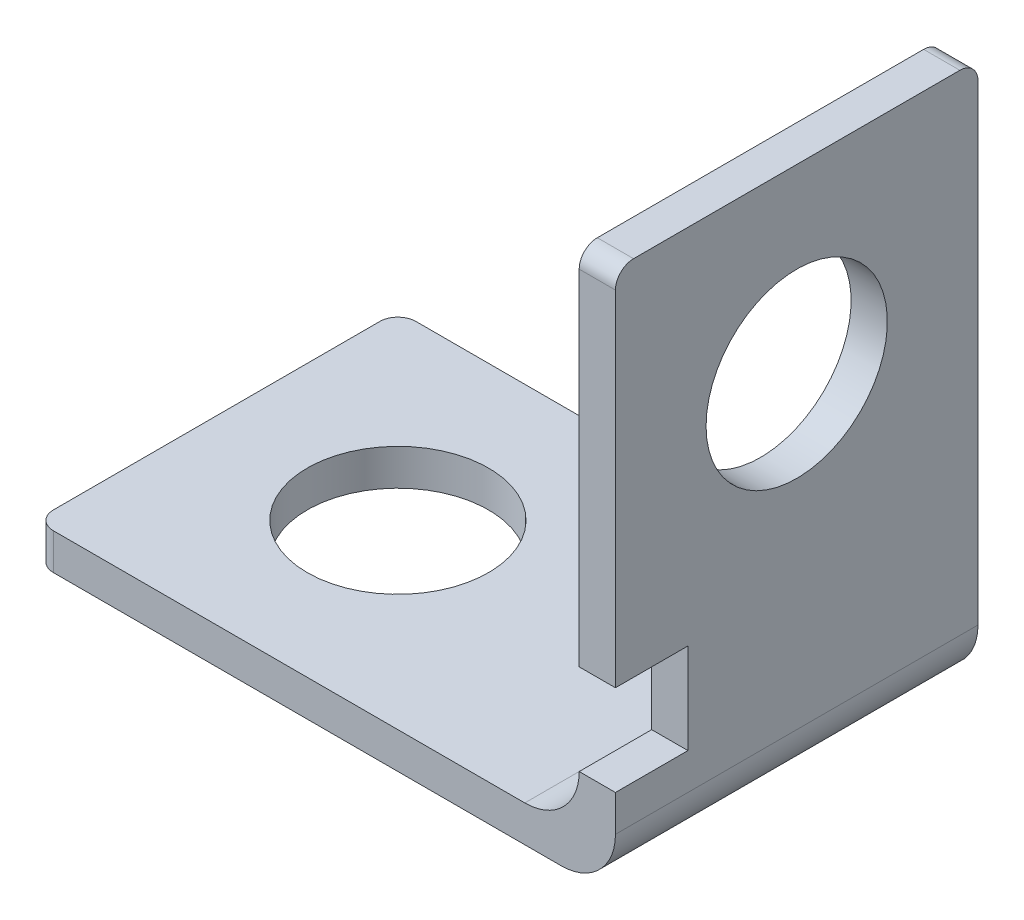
SolidWorks part; units mm, degrees
ref_plane "Front Plane" through (0, 0, 0) normal (0, 0, 1) x (1, 0, 0)
ref_plane "Top Plane" through (0, 0, 0) normal (0, 1, 0) x (1, 0, 0)
ref_plane "Right Plane" through (0, 0, 0) normal (1, 0, 0) x (0, 0, -1)
sketch "Sketch1" plane through (0, 0, 0) normal (0, 1, 0) x (1, 0, 0)
  line L1 (0, 0) -> (32, 0)
  line L2 (0, 0) -> (0, -20)
  line L3 (0, -20) -> (32, -20)
  line L4 (32, 0) -> (32, -20)
  dimension "D1" = 32
  dimension "D2" = 20
extrude "Boss-Extrude1" add sketch "Sketch1" along normal blind 2
sketch "Sketch2" plane through (0, 2, 0) normal (0, 1, 0) x (1, 0, 0)
  line L0 (0, -20) -> (32, -20) construction
  line L1 (0, 0) -> (0, -20) construction
  circle A0 centre (10, -10) radius 5
  dimension "D1" = 10
  dimension "D2" = 10
  dimension "D3" = 10
extrude "Cut-Extrude1" cut sketch "Sketch2" against normal blind 13
fillet "Fillet1" radius 1 2 edges at (0, 1, 20) (0, 1, 0)
sketch "Sketch5" plane through (0, 2, 0) normal (0, 1, 0) x (1, 0, 0)
  line L0 (1, -20) -> (32, -20) construction
  line L1 (32, 0) -> (30, 0)
  line L2 (32, 0) -> (32, -20)
  line L3 (32, -20) -> (30, -20)
  line L4 (30, 0) -> (30, -20)
  dimension "D1" = 2
extrude "Boss-Extrude2" add sketch "Sketch5" along normal blind 28
fillet "Fillet2" radius 3 2 edges at (32, 0, 10) (30, 2, 10)
sketch "Sketch6" plane through (30, 0, 0) normal (-1, 0, 0) x (0, 0, 1)
  line L1 (20, 5) -> (16, 5)
  line L2 (20, 5) -> (20, 10)
  line L3 (20, 10) -> (16, 10)
  line L4 (16, 5) -> (16, 10)
  dimension "D1" = 5
  dimension "D2" = 4
extrude "Cut-Extrude2" cut sketch "Sketch6" against normal blind 30
fillet "Fillet3" radius 1 2 edges at (31, 30, 0) (31, 30, 20)
sketch "Sketch7" plane through (30, 0, 0) normal (-1, 0, 0) x (0, 0, 1)
  line L0 (20, 29) -> (20, 10) construction
  line L1 (1, 30) -> (19, 30) construction
  circle A0 centre (10, 20) radius 5
  dimension "D1" = 10
  dimension "D2" = 10
  dimension "D3" = 10
extrude "Cut-Extrude3" cut sketch "Sketch7" against normal blind 30
